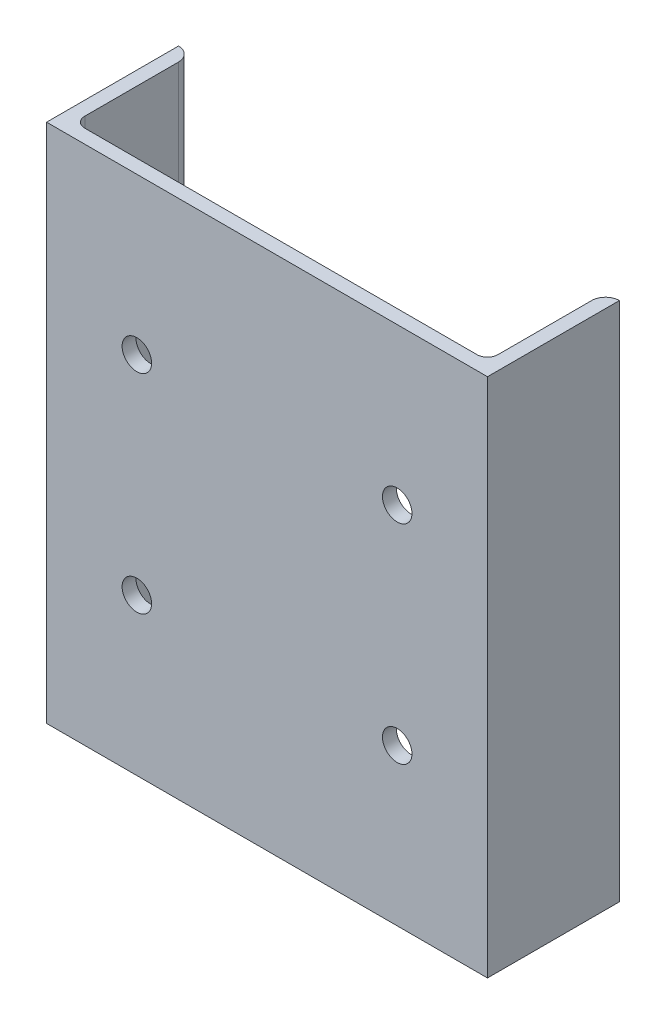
SolidWorks part; units mm, degrees
ref_plane "Front Plane" through (0, 0, 0) normal (0, 0, 1) x (1, 0, 0)
ref_plane "Top Plane" through (0, 0, 0) normal (0, 1, 0) x (1, 0, 0)
ref_plane "Right Plane" through (0, 0, 0) normal (1, 0, 0) x (0, 0, -1)
sketch "Sketch1" plane through (0, 0, 0) normal (0, 1, 0) x (1, 0, 0)
  line L0 (-127, 0) -> (127, 0)
  line L1 (-127, 0) -> (-127, 76)
  line L2 (127, 0) -> (127, 76)
  line L3 (-113, 8) -> (113, 8)
  line L4 (119, 14) -> (119, 68)
  line L5 (-119, 14) -> (-119, 68)
  arc A0 (113, 8) -> (119, 14) centre (113, 14) ccw
  arc A1 (-113, 8) -> (-119, 14) centre (-113, 14) cw
  arc A2 (119, 68) -> (127, 76) centre (127, 68) cw
  arc A3 (-119, 68) -> (-127, 76) centre (-127, 68) ccw
  point P11 (119, 8)
  point P14 (-119, 8)
  dimension "D6" = 6
  dimension "D7" = 6
  dimension "D1" = 254
  dimension "D2" = 238
  dimension "D3" = 60
  dimension "D4" = 76
  dimension "D5" = 8
  dimension "D8" = 127
  dimension "D9" = 119
extrude "Extrude1" add sketch "Sketch1" along normal mid plane 300
sketch "Sketch2" plane through (0, 0, 0) normal (0, 0, 1) x (1, 0, 0)
  line L0 (127, 150) -> (127, -150) construction
  circle A0 centre (75, 60) radius 8.5
  circle A1 centre (-75, 60) radius 8.5
  circle A2 centre (-75, -60) radius 8.5
  circle A3 centre (75, -60) radius 8.5
  dimension "D1" = 17
  dimension "D2" = 60
  dimension "D3" = 60
  dimension "D4" = 60
  dimension "D5" = 60
  dimension "D6" = 52
  dimension "D7" = 52
  dimension "D8" = 150
  dimension "D9" = 150
extrude "Cut-Extrude1" cut sketch "Sketch2" against normal up to next
